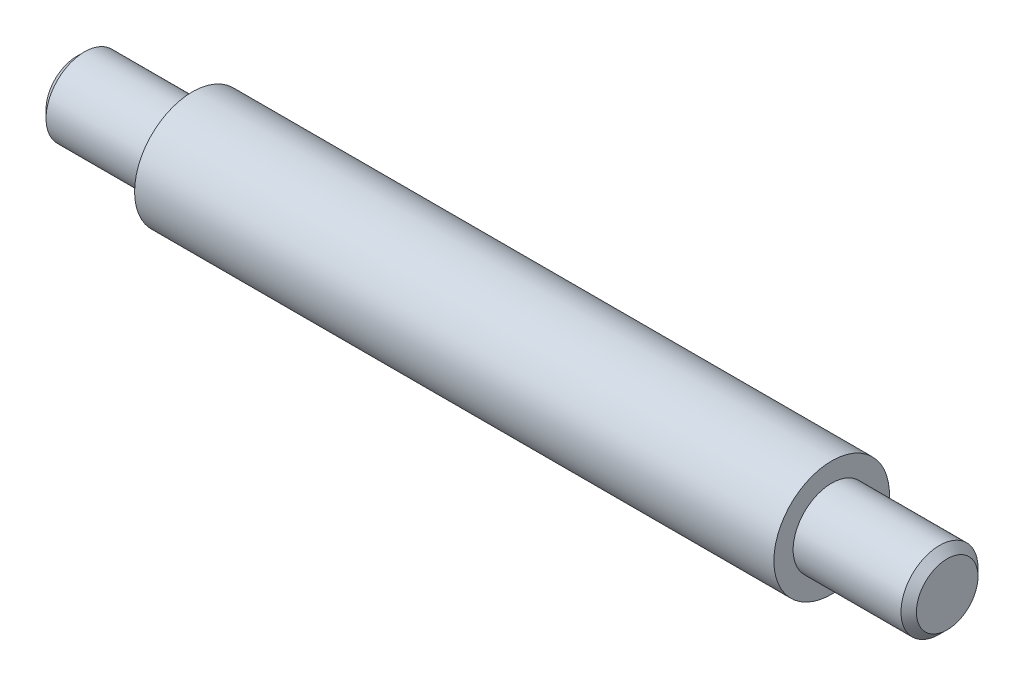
SolidWorks part; units mm, degrees
ref_plane "Ebene vorne" through (0, 0, 0) normal (0, 0, 1) x (1, 0, 0)
ref_plane "Ebene oben" through (0, 0, 0) normal (0, 1, 0) x (1, 0, 0)
ref_plane "Ebene rechts" through (0, 0, 0) normal (1, 0, 0) x (0, 0, -1)
sketch "Skizze1" plane through (0, 0, 0) normal (1, 0, 0) x (0, 0, -1)
  circle A0 centre (0, 0) radius 0.5
  dimension "D1" = 1
extrude "Linear austragen1" add sketch "Skizze1" along normal blind 1.5
sketch "Skizze2" plane through (1.5, 0, 0) normal (1, 0, 0) x (0, 0, -1)
  circle A0 centre (0, 0) radius 0.75
  dimension "D1" = 1.5
extrude "Linear austragen2" add sketch "Skizze2" along normal blind 8.3
sketch "Skizze3" plane through (9.8, 0, 0) normal (1, 0, 0) x (0, 0, -1)
  circle A0 centre (0, 0) radius 0.5
  dimension "D1" = 1
extrude "Linear austragen3" add sketch "Skizze3" along normal blind 1.5
chamfer "Fase1" distance 0.1 angle 45 2 edges at (11.3, 0, -0.5) (0, 0, -0.5)
